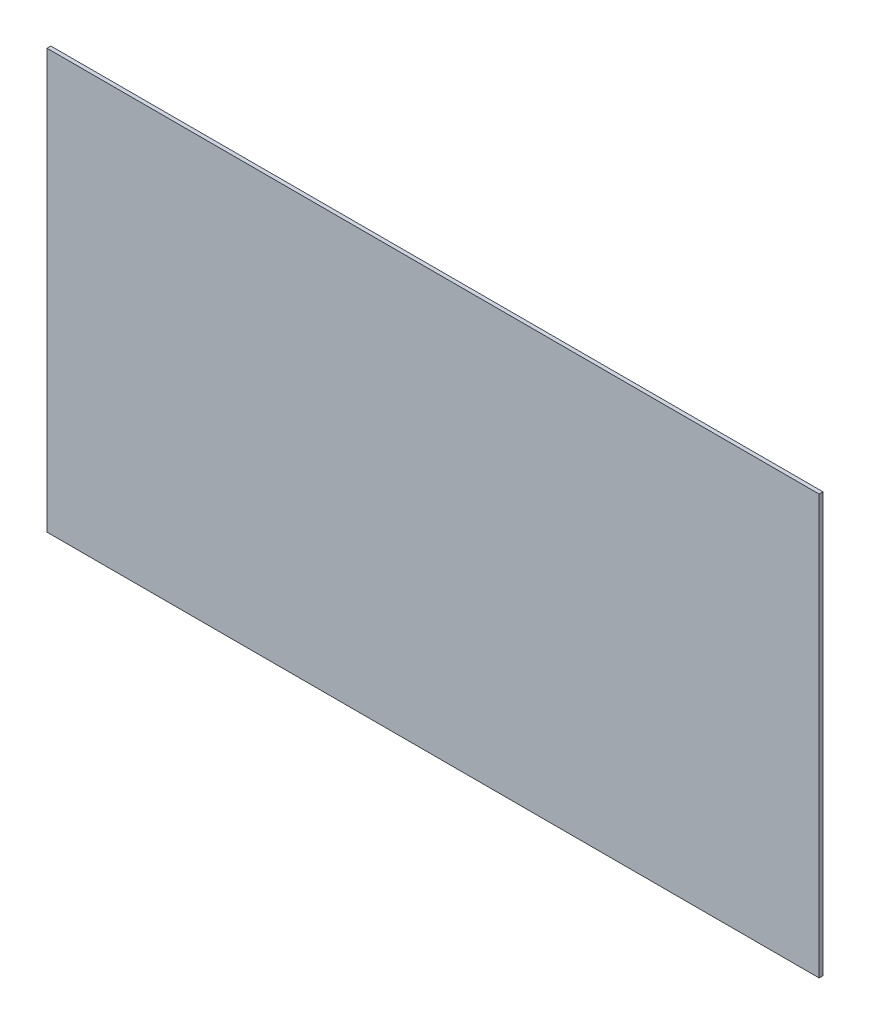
SolidWorks part; units mm, degrees
ref_plane "Front Plane" through (0, 0, 0) normal (0, 0, 1) x (1, 0, 0)
ref_plane "Top Plane" through (0, 0, 0) normal (0, 1, 0) x (1, 0, 0)
ref_plane "Right Plane" through (0, 0, 0) normal (1, 0, 0) x (0, 0, -1)
sketch "Sketch1" plane through (0, 0, 0) normal (0, 0, 1) x (1, 0, 0)
  line L0 (125.9224, -52.8916) -> (125.9224, 55.6588)
  line L1 (125.9224, 55.6588) -> (-74.0776, 55.6588)
  line L2 (-74.0776, 55.6588) -> (-74.0776, -52.8916)
  line L3 (-74.0776, -52.8916) -> (125.9224, -52.8916)
  dimension "D1" = 200
  dimension "D2" = 108.5504
extrude "Boss-Extrude1" add sketch "Sketch1" along normal blind 1
